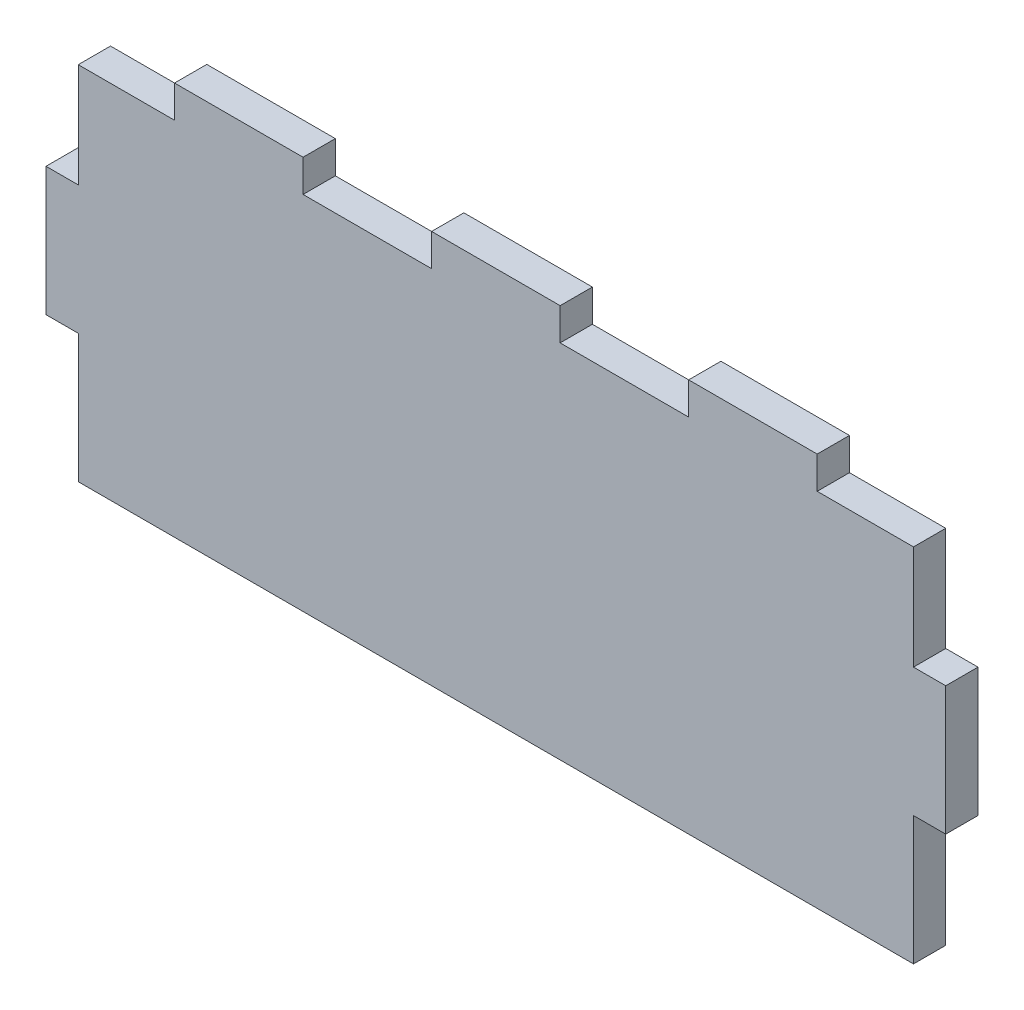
SolidWorks part; units mm, degrees
ref_plane "Front Plane" through (0, 0, 0) normal (0, 0, 1) x (1, 0, 0)
ref_plane "Top Plane" through (0, 0, 0) normal (0, 1, 0) x (1, 0, 0)
ref_plane "Right Plane" through (0, 0, 0) normal (1, 0, 0) x (0, 0, -1)
sketch "Sketch1" plane through (0, 0, 0) normal (0, 0, 1) x (1, 0, 0)
  line L0 (-213.0846, 169.1103) -> (-213.0846, 150.1103)
  line L1 (-213.0846, 169.1103) -> (-137.3703, 169.1103)
  line L2 (-288.7989, 88.7789) -> (-288.7989, 13.0646)
  line L3 (-269.7989, -62.6497) -> (222.2011, -62.6497)
  line L4 (241.2011, 88.7789) -> (241.2011, 13.0646)
  line L5 (165.4868, 169.1103) -> (165.4868, 150.1103)
  line L6 (89.7725, 169.1103) -> (89.7725, 150.1103)
  line L7 (14.0583, 169.1103) -> (14.0583, 150.1103)
  line L8 (-61.656, 169.1103) -> (-61.656, 150.1103)
  line L9 (-137.3703, 169.1103) -> (-137.3703, 150.1103)
  line L10 (-269.7989, 150.1103) -> (-213.0846, 150.1103)
  line L12 (89.7725, 169.1103) -> (165.4868, 169.1103)
  line L13 (-61.656, 169.1103) -> (14.0583, 169.1103)
  line L15 (-137.3703, 150.1103) -> (-61.656, 150.1103)
  line L17 (14.0583, 150.1103) -> (89.7725, 150.1103)
  line L18 (165.4868, 150.1103) -> (222.2011, 150.1103)
  line L26 (-288.7989, 13.0646) -> (-269.7989, 13.0646)
  line L27 (-288.7989, 88.7789) -> (-269.7989, 88.7789)
  line L28 (222.2011, 150.1103) -> (222.2011, 88.7789)
  line L29 (-269.7989, 150.1103) -> (-269.7989, 88.7789)
  line L32 (222.2011, 13.0646) -> (222.2011, -62.6497)
  line L34 (222.2011, 88.7789) -> (241.2011, 88.7789)
  line L36 (222.2011, 13.0646) -> (241.2011, 13.0646)
  line L39 (-269.7989, 13.0646) -> (-269.7989, -62.6497)
  dimension "D1" = 19
  dimension "D2" = 530
  dimension "D3" = 231.76
extrude "Boss-Extrude1" add sketch "Sketch1" along normal blind 19
